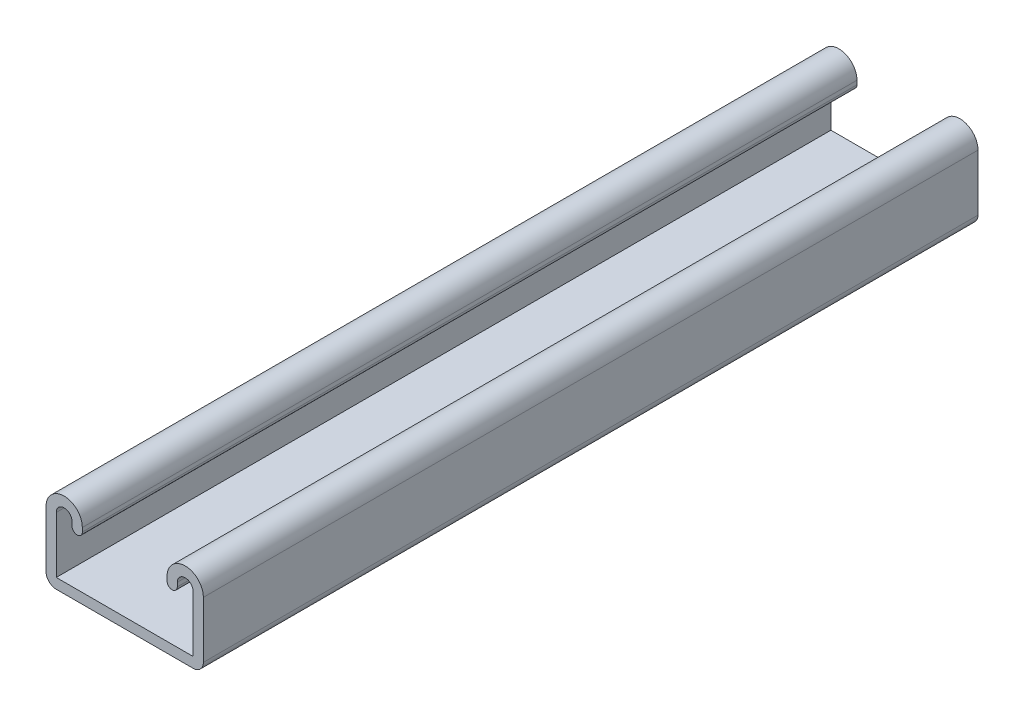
SolidWorks part; units mm, degrees
ref_plane "Plane1" through (0, 0, 0) normal (0, 0, 1) x (1, 0, 0)
ref_plane "Plane2" through (0, 0, 0) normal (0, 1, 0) x (1, 0, 0)
ref_plane "Plane3" through (0, 0, 0) normal (1, 0, 0) x (0, 0, -1)
sketch "Sketch1" plane through (0, 0, 0) normal (0, 0, 1) x (1, 0, 0)
  line L0 (-20.6375, 8.3693) -> (-20.6375, -6.4008)
  line L1 (-17.9451, -9.0932) -> (17.9451, -9.0932)
  line L2 (20.6375, -6.4008) -> (20.6375, 8.3693)
  line L3 (11.1125, 8.3693) -> (11.1125, 7.3343)
  line L4 (-11.1125, 8.3693) -> (-11.1125, 7.3343)
  line L5 (-13.8049, 8.3693) -> (-13.8049, 7.3343)
  line L6 (-17.9451, 8.3693) -> (-17.9451, -6.4008)
  line L7 (-17.9451, -6.4008) -> (17.9451, -6.4008)
  line L8 (17.9451, -6.4008) -> (17.9451, 8.3693)
  line L9 (13.8049, 8.3693) -> (13.8049, 7.3343)
  line L10 (-25.4, 13.1318) -> (25.4, 13.1318) construction
  line L11 (-12.8524, 5.9881) -> (12.8524, 5.9881) construction
  arc A0 (20.6375, 8.3693) -> (11.1125, 8.3693) centre (15.875, 8.3693) ccw
  arc A1 (-20.6375, 8.3693) -> (-11.1125, 8.3693) centre (-15.875, 8.3693) cw
  arc A2 (-17.9451, -9.0932) -> (-20.6375, -6.4008) centre (-17.9451, -6.4008) cw
  arc A3 (17.9451, -9.0932) -> (20.6375, -6.4008) centre (17.9451, -6.4008) ccw
  arc A4 (-17.9451, 8.3693) -> (-13.8049, 8.3693) centre (-15.875, 8.3693) cw
  arc A5 (17.9451, 8.3693) -> (13.8049, 8.3693) centre (15.875, 8.3693) ccw
  arc A6 (11.1125, 7.3343) -> (13.8049, 7.3343) centre (12.4587, 7.3343) ccw
  arc A7 (-11.1125, 7.3343) -> (-13.8049, 7.3343) centre (-12.4587, 7.3343) cw
  dimension "D1" = 2.6924
  dimension "D3" = 20.6375
  dimension "Width" = 41.275
  dimension "D5" = 9.0932
  dimension "D6" = 9.525
  dimension "D7" = 22.225
  dimension "D8" = 13.1318
  dimension "D9" = 7.1437
  dimension "gauge" = 2.6924
extrude "Base-Extrude" add sketch "Sketch1" along normal blind 203.2
extrude "Slot" cut sketch "Sketch2" against normal through all
sketch "Sketch2" plane through (0, -9.0932, -16.7242) normal (0, -1, 0) x (1, 0, 0)
  line L0 (5.1594, 95.3055) -> (5.1594, 29.4242)
  line L1 (-5.1594, 29.4242) -> (-5.1594, 95.3055)
  arc A0 (-5.1594, 29.4242) -> (5.1594, 29.4242) centre (0, 29.4242) ccw
  arc A1 (5.1594, 95.3055) -> (-5.1594, 95.3055) centre (0, 95.3055) ccw
  dimension "D3" = 10.3187
  dimension "D1" = 12.7
  dimension "D2" = 65.8813
pattern_linear "LPattern1" count 2 spacing 101.6 along (0, 0, 1) of "Slot"
equation "\"D3@Sketch1\" = \"Width@Sketch1\" / 2"
equation "\"D7@Sketch1\" = \"Width@Sketch1\" - 2 * \"D6@Sketch1\""
equation "\"D1@Sketch1\" = \"gauge@Sketch1\""
equation "\"D1@LPattern1\" = \"D1@Base-Extrude\" / \"D3@LPattern1\""
